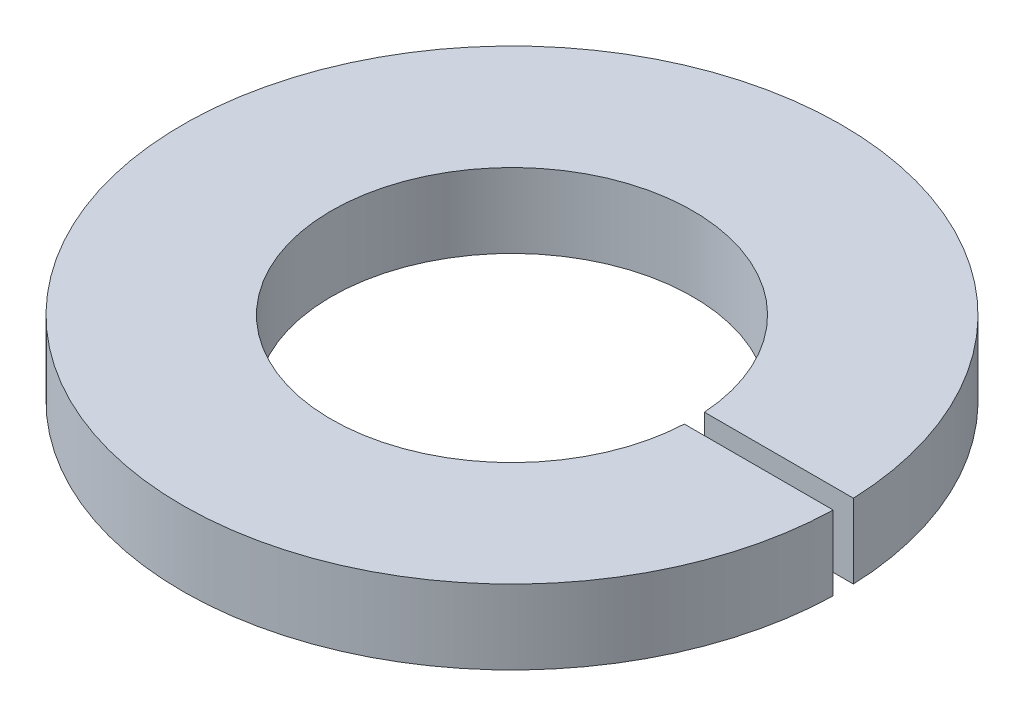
SolidWorks part; units mm, degrees
ref_plane "Front Plane" through (0, 0, 0) normal (0, 0, 1) x (1, 0, 0)
ref_plane "Top Plane" through (0, 0, 0) normal (0, 1, 0) x (1, 0, 0)
ref_plane "Right Plane" through (0, 0, 0) normal (1, 0, 0) x (0, 0, -1)
sketch "Sketch1" plane through (0, 0, 0) normal (0, 1, 0) x (1, 0, 0)
  circle A0 centre (0, 0) radius 3.1
  dimension "D1" = 6.2
extrude "Extrude1" add sketch "Sketch1" along normal blind 0.7
sketch "Sketch2" plane through (0, 0.7, 0) normal (0, 1, 0) x (1, 0, 0)
  circle A0 centre (0, 0) radius 1.7
  dimension "D1" = 3.4
extrude "Cut-Extrude1" cut sketch "Sketch2" against normal through all
sketch "Sketch3" plane through (0, 0.7, 0) normal (0, 1, 0) x (1, 0, 0)
  line L1 (1.6962, 0.1139) -> (3.2057, 0.1139)
  line L2 (1.6962, 0.1139) -> (1.6962, -0.0776)
  line L3 (1.6962, -0.0776) -> (3.2057, -0.0776)
  line L4 (3.2057, 0.1139) -> (3.2057, -0.0776)
  circle A0 centre (0, 0) radius 1.7 construction
extrude "Cut-Extrude3" cut sketch "Sketch3" against normal through all
